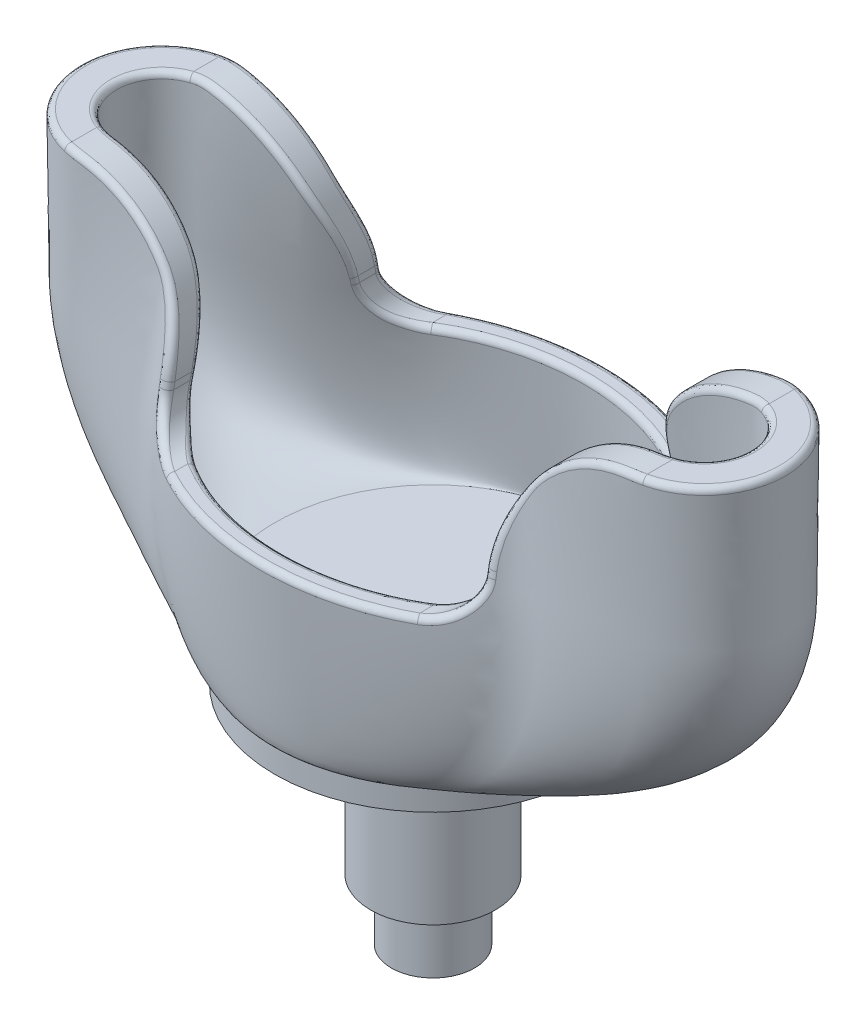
SolidWorks part; units mm, degrees
ref_plane "Front Plane" through (0, 0, 0) normal (0, 0, 1) x (1, 0, 0)
ref_plane "Top Plane" through (0, 0, 0) normal (0, 1, 0) x (1, 0, 0)
ref_plane "Right Plane" through (0, 0, 0) normal (1, 0, 0) x (0, 0, -1)
other "Configuration Table"
sketch "Sketch1" plane through (0, 0, 0) normal (0, 0, 1) x (1, 0, 0)
  line L0 (0, 10.7344) -> (0, -7.5424) construction
  line L1 (4.445, 5.334) -> (4.445, 6.5193)
  line L2 (-4.445, 0) -> (4.445, 0)
  line L3 (9.906, 10.16) -> (8.0857, 10.16)
  line L4 (-4.445, 5.334) -> (4.445, 5.334)
  line L5 (9.906, 10.16) -> (8.3762, 10.16) construction
  line L6 (9.906, 10.16) -> (9.906, 5.7504) construction
  line L7 (9.906, 10.16) -> (9.906, 6.1278)
  line L8 (4.445, 0) -> (4.445, 0.6667)
  line L9 (4.445, 0.6667) -> (0.3077, 0.6667) construction
  line L10 (-4.445, 0) -> (-4.445, 0.6667)
  line L11 (-9.906, 10.16) -> (-9.906, 6.1277)
  line L12 (-9.906, 10.16) -> (-8.0857, 10.16)
  line L13 (-4.445, 5.334) -> (-4.445, 6.5193)
  arc A5 (8.0857, 10.16) -> (4.445, 6.5193) centre (8.0857, 6.5193) ccw
  arc A6 (4.445, 0.6667) -> (9.906, 6.1278) centre (4.445, 6.1277) ccw
  arc A7 (-8.0857, 10.16) -> (-4.445, 6.5193) centre (-8.0857, 6.5193) cw
  arc A8 (-4.445, 0.6667) -> (-9.906, 6.1277) centre (-4.445, 6.1277) cw
  point P4 (0, 5.334)
  point P19 (0, 0)
ref_plane "Plane4" through (0, 10.16, 0) normal (0, 1, 0) x (-1, 0, 0)
ref_plane "Plane5" through (0, 0.6667, 0) normal (0, 1, 0) x (-1, 0, 0)
sketch "Sketch2" plane through (0, 10.16, 0) normal (0, 1, 0) x (-1, 0, 0)
  line L0 (4.445, 0) -> (-4.445, 0) construction
  line L1 (5.1243, -2.286) -> (7.62, -2.286)
  line L2 (0, 0) -> (14.2067, 0) construction
  line L3 (5.1243, 2.286) -> (7.62, 2.286)
  line L4 (0, 0) -> (0, 10.869) construction
  line L5 (0, 0) -> (0, -9.6836) construction
  line L6 (-5.1243, 2.286) -> (-7.62, 2.286)
  line L7 (-5.1243, -2.286) -> (-7.62, -2.286)
  arc A0 (4.2702, 2.7517) -> (-4.2702, 2.7517) centre (0, 0) ccw
  arc A1 (7.62, 2.286) -> (7.62, -2.286) centre (7.62, 0) cw
  arc A2 (-4.2702, -2.7517) -> (4.2702, -2.7517) centre (0, 0) ccw
  arc A3 (-7.62, 2.286) -> (-7.62, -2.286) centre (-7.62, 0) ccw
  arc A4 (-5.1243, 2.286) -> (-4.2702, 2.7517) centre (-5.1243, 3.302) ccw
  arc A5 (-5.1243, -2.286) -> (-4.2702, -2.7517) centre (-5.1243, -3.302) cw
  arc A6 (5.1243, 2.286) -> (4.2702, 2.7517) centre (5.1243, 3.302) cw
  arc A7 (5.1243, -2.286) -> (4.2702, -2.7517) centre (5.1243, -3.302) ccw
  point P20 (-4.5366, 2.286)
  point P23 (-4.5366, -2.286)
  point P26 (4.5366, 2.286)
  point P29 (4.5366, -2.286)
  dimension "F" = 10.16
  dimension "C" = 4.572
sketch "Sketch9" plane through (0, 0, 0) normal (0, 0, 1) x (1, 0, 0)
  line L0 (-9.906, 10.16) -> (-9.906, 6.1277) construction
  line L1 (-9.906, 10.16) -> (-9.906, 6.1277)
  arc A0 (-9.906, 6.1277) -> (-4.445, 0.6667) centre (-4.445, 6.1277) ccw construction
  arc A2 (-9.906, 6.1277) -> (-4.445, 0.6667) centre (-4.445, 6.1277) ccw
sketch "Sketch10" plane through (0, 0, 0) normal (0, 0, 1) x (1, 0, 0)
  line L0 (9.906, 10.16) -> (9.906, 6.1277) construction
  line L1 (9.906, 10.16) -> (9.906, 6.1277)
  arc A1 (4.445, 0.6668) -> (9.906, 6.1277) centre (4.445, 6.1277) ccw construction
  arc A2 (4.445, 0.6668) -> (9.906, 6.1277) centre (4.445, 6.1277) ccw
sketch "Sketch18" plane through (0, 0.6667, 0) normal (0, 1, 0) x (-1, 0, 0)
  circle A0 centre (0, 0) radius 4.445
loft "Loft2" add profiles "Sketch18", "Sketch2"
ref_plane "Plane6" through (0, 1.6827, 0) normal (0, 1, 0) x (-1, 0, 0)
sketch "Sketch20" plane through (0, 1.6827, 0) normal (0, 1, 0) x (-1, 0, 0)
  circle A0 centre (0, 0) radius 4.445 construction
  circle A1 centre (0, 0) radius 4.445
sketch "Sketch21" plane through (0, 10.16, 0) normal (0, 1, 0) x (-1, 0, 0)
  line L8 (-5.1243, 1.27) -> (-7.62, 1.27)
  line L9 (-7.62, -1.27) -> (-5.1243, -1.27)
  line L10 (5.1243, -1.27) -> (7.62, -1.27)
  line L11 (7.62, 1.27) -> (5.1243, 1.27)
  line L12 (-5.1243, 1.27) -> (-7.62, 1.27)
  line L13 (-7.62, -1.27) -> (-5.1243, -1.27)
  line L14 (5.1243, -1.27) -> (7.62, -1.27)
  line L15 (7.62, 1.27) -> (5.1243, 1.27)
  arc A16 (-7.62, 1.27) -> (-7.62, -1.27) centre (-7.62, 0) ccw
  arc A17 (-3.4162, -2.2013) -> (-5.1243, -1.27) centre (-5.1243, -3.302) ccw
  arc A18 (-3.4162, -2.2013) -> (3.4162, -2.2013) centre (0, 0) ccw
  arc A19 (5.1243, -1.27) -> (3.4162, -2.2013) centre (5.1243, -3.302) ccw
  arc A20 (7.62, -1.27) -> (7.62, 1.27) centre (7.62, 0) ccw
  arc A21 (3.4162, 2.2013) -> (5.1243, 1.27) centre (5.1243, 3.302) ccw
  arc A22 (3.4162, 2.2013) -> (-3.4162, 2.2013) centre (0, 0) ccw
  arc A23 (-5.1243, 1.27) -> (-3.4162, 2.2013) centre (-5.1243, 3.302) ccw
  arc A24 (-7.62, 1.27) -> (-7.62, -1.27) centre (-7.62, 0) ccw
  arc A25 (-3.4162, -2.2013) -> (-5.1243, -1.27) centre (-5.1243, -3.302) ccw
  arc A26 (-3.4162, -2.2013) -> (3.4162, -2.2013) centre (0, 0) ccw
  arc A27 (5.1243, -1.27) -> (3.4162, -2.2013) centre (5.1243, -3.302) ccw
  arc A28 (7.62, -1.27) -> (7.62, 1.27) centre (7.62, 0) ccw
  arc A29 (3.4162, 2.2013) -> (5.1243, 1.27) centre (5.1243, 3.302) ccw
  arc A30 (3.4162, 2.2013) -> (-3.4162, 2.2013) centre (0, 0) ccw
  arc A31 (-5.1243, 1.27) -> (-3.4162, 2.2013) centre (-5.1243, 3.302) ccw
sketch "Sketch22" plane through (0, 0, 0) normal (0, 0, 1) x (1, 0, 0)
  line L2 (-8.89, 10.16) -> (-8.89, 6.1277)
  line L3 (-8.89, 10.16) -> (-8.89, 6.1277)
  arc A2 (-8.89, 6.1277) -> (-4.445, 1.6827) centre (-4.445, 6.1277) ccw
  arc A3 (-8.89, 6.1277) -> (-4.445, 1.6827) centre (-4.445, 6.1277) ccw
sketch "Sketch23" plane through (0, 0, 0) normal (0, 0, 1) x (1, 0, 0)
  line L2 (8.89, 10.16) -> (8.89, 6.1277)
  line L3 (8.89, 10.16) -> (8.89, 6.1277)
  arc A2 (4.445, 1.6828) -> (8.89, 6.1277) centre (4.445, 6.1277) ccw
  arc A3 (4.445, 1.6828) -> (8.89, 6.1277) centre (4.445, 6.1277) ccw
loft "Cut-Loft1" cut profiles "Sketch20", "Sketch21"
sketch "Sketch14" plane through (0, 0, 0) normal (0, 0, 1) x (1, 0, 0)
  line L0 (0, 0) -> (0, -9.7552) construction
  line L2 (0, 0) -> (0, -6.35)
  line L3 (0, -6.35) -> (1.7526, -6.35)
  line L4 (1.7526, 0) -> (1.7526, -6.35)
  line L5 (1.7526, 0) -> (4.445, 0)
  line L6 (4.445, 0) -> (4.445, 0.6667)
  line L7 (4.445, 0.6667) -> (0, 0.6667)
  line L8 (0, 10.7344) -> (0, -7.5424) construction
  line L9 (6.9245, 0.6667) -> (-6.9245, 0.6667) construction
  line L10 (0, 0.6667) -> (0, 0)
revolve "Revolve1" add sketch "Sketch14" angle 360 about L0
sketch "Sketch16" plane through (0, 0, 0) normal (0, 0, 1) x (1, 0, 0)
  line L0 (-9.906, 10.16) -> (-9.906, 11.16)
  line L1 (-9.906, 11.16) -> (9.906, 11.16)
  line L2 (9.906, 11.16) -> (9.906, 10.16)
  line L10 (-4.445, 0) -> (4.445, 0)
  line L11 (4.445, 0) -> (4.445, 0.6667)
  line L12 (9.906, 6.1277) -> (9.906, 10.16)
  line L13 (9.906, 10.16) -> (8.0857, 10.16)
  line L14 (4.445, 6.5193) -> (4.445, 5.334)
  line L15 (4.445, 5.334) -> (-4.445, 5.334)
  line L16 (-4.445, 5.334) -> (-4.445, 6.5193)
  line L17 (-8.0857, 10.16) -> (-9.906, 10.16)
  line L18 (-9.906, 10.16) -> (-9.906, 6.1277)
  line L19 (-4.445, 0.6667) -> (-4.445, 0)
  line L23 (9.906, 10.16) -> (8.0857, 10.16)
  line L24 (4.445, 6.5193) -> (4.445, 5.334)
  line L25 (4.445, 5.334) -> (-4.445, 5.334)
  line L26 (-4.445, 5.334) -> (-4.445, 6.5193)
  line L27 (-8.0857, 10.16) -> (-9.906, 10.16)
  arc A4 (4.445, 0.6667) -> (9.906, 6.1277) centre (4.445, 6.1277) ccw
  arc A5 (8.0857, 10.16) -> (4.445, 6.5193) centre (8.0857, 6.5193) ccw
  arc A6 (-4.445, 6.5193) -> (-8.0857, 10.16) centre (-8.0857, 6.5193) ccw
  arc A7 (-9.906, 6.1277) -> (-4.445, 0.6667) centre (-4.445, 6.1277) ccw
  arc A9 (8.0857, 10.16) -> (4.445, 6.5193) centre (8.0857, 6.5193) ccw
  arc A10 (-4.445, 6.5193) -> (-8.0857, 10.16) centre (-8.0857, 6.5193) ccw
  dimension "D2" = 1
  dimension "D1" = 0
extrude "Cut-Extrude1" cut sketch "Sketch16" against normal through all and the other way through all
fillet "Fillet1" radius 1 4 edges at (4.445, 5.334, -2.924) (4.445, 5.334, 2.924) (-4.445, 5.334, -2.924) (-4.445, 5.334, 2.924)
fillet "Fillet2" radius 0.1693 32 edges at (-5.4656, 9.0471, -1.4153) (-5.968, 9.4808, 1.3386) (-4.1482, 5.623, -2.6418) (0.7192, 5.334, -4.1865) (4.2763, 5.7781, -2.5192) (5.4656, 9.0471, 1.4153) (5.968, 9.4808, -1.3386) (4.1482, 5.623, 2.6418) (-0.7192, 5.334, 4.1865) (-4.2763, 5.7781, 2.5192) (-5.3715, 8.9458, 2.3716) (-5.3444, 8.9152, -2.375) (-4.2761, 5.7779, -3.4455) (1.9112, 5.334, -4.5997) (4.1338, 5.609, -3.5649) (5.3444, 8.9152, 2.375) (5.3715, 8.9458, -2.3716) (4.2761, 5.7779, 3.4455) (-1.9112, 5.334, 4.5997) (-4.1338, 5.609, 3.5649)
sketch "Sketch27" plane through (0, 0, 0) normal (0, 0, 1) x (1, 0, 0)
  line L0 (0, 0) -> (0, -9.1725) construction
  line L1 (-4.445, 0) -> (4.445, 0) construction
  line L2 (1.1684, -6.35) -> (1.1684, -6.604)
  line L3 (-1.7526, -6.35) -> (1.7526, -6.35) construction
  line L4 (1.9279, -4.6455) -> (1.7526, -4.6455)
  line L5 (1.1684, -6.604) -> (1.9279, -6.604)
  line L6 (1.9279, -6.604) -> (1.9279, -4.6455)
  line L7 (1.1684, -6.35) -> (1.1684, -5.0546)
  line L8 (1.1684, -5.0546) -> (1.7526, -4.6455)
  line L9 (1.7526, -6.35) -> (1.7526, 0) construction
revolve "Cut-Revolve11" cut sketch "Sketch27" angle 360 about L0
sketch "Sketch26" plane through (0, 0, 0) normal (0, 0, 1) x (1, 0, 0)
  line L0 (0, 0) -> (0, -6.8807) construction
  line L1 (-1.7526, 0) -> (1.7526, 0) construction
  line L2 (1.2802, -0.2753) -> (1.7526, -0.0025)
  line L3 (1.7526, -0.0025) -> (1.7526, -0.5481)
  line L4 (1.7526, -0.5481) -> (1.2802, -0.2753)
  line L9 (1.2802, -0.2753) -> (1.2802, -1.0678) construction
revolve "Cut-Revolve10" [suppressed] cut sketch "Sketch26" angle 360 about L0
pattern_linear "LPattern10" [suppressed] count 8 along (0, -1, 0)
equation "\"D1@Sketch1\" = (  \"A@Sketch1\" - \"EE@Sketch1\"  ) / 2 / 3"
equation "\"D2@Sketch1\" = \"G@Sketch1\" / 8"
equation "\"D1@LPattern10\" =\"L@Sketch14\" / \"pitch@Sketch26\" "
equation "\"EE@Sketch1\" = \"E@Sketch1\""
equation "\"LL@Cosmetic Thread1\" = \"L@Sketch14\""
equation "\"D3@Sketch27\" = \"d1@Sketch14\" * 1.1 / 2"
equation "\"D1@Fillet2\" = \"T\" / 6"
equation "\"D1@Sketch26\" = \"d1@Sketch14\""
equation "\"D2@Sketch26\" = \"THD_MINOR@Cosmetic Thread1\""
equation "\"PITCH@LPattern10\" = \"pitch@Sketch26\""
